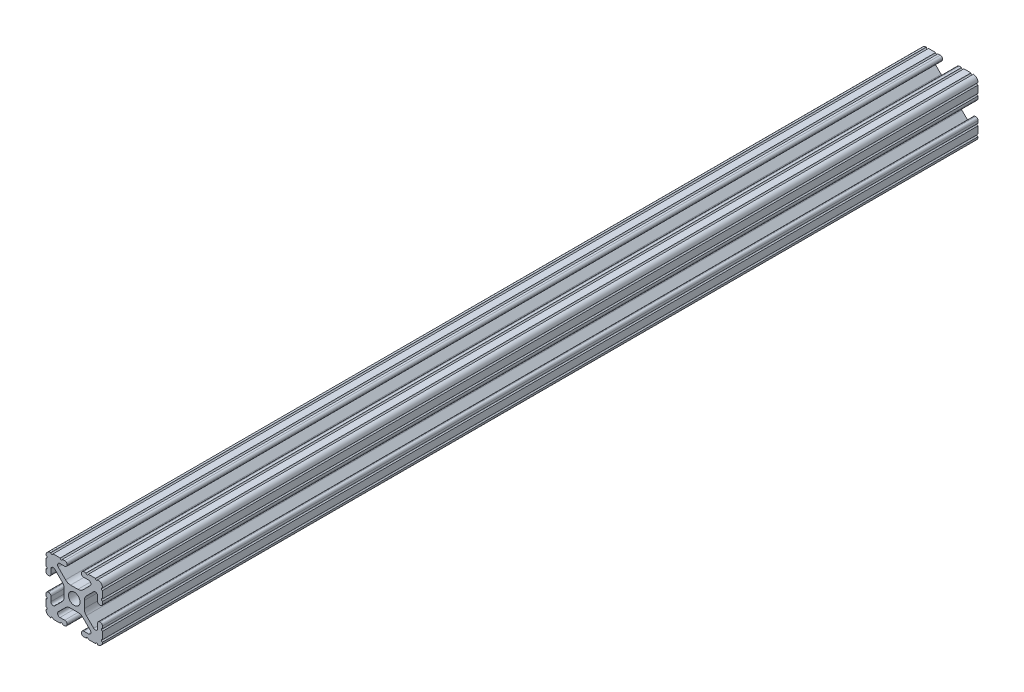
SolidWorks part; units mm, degrees
ref_plane "Front Plane" through (0, 0, 0) normal (0, 0, 1) x (1, 0, 0)
ref_plane "Top Plane" through (0, 0, 0) normal (0, 1, 0) x (1, 0, 0)
ref_plane "Right Plane" through (0, 0, 0) normal (1, 0, 0) x (0, 0, -1)
sketch "Sketch1" plane through (0, 0, 0) normal (0, 0, 1) x (1, 0, 0)
  line L88 (-7.1797, -8.6452) -> (-3.9523, -5.4237)
  line L89 (-1.7093, -4.4958) -> (1.7093, -4.4958)
  line L90 (3.9523, -5.4237) -> (7.1797, -8.6452)
  line L91 (6.4164, -10.4902) -> (4.2875, -10.4902)
  line L92 (3.2385, -11.5392) -> (3.2385, -11.651)
  line L93 (4.2875, -12.7) -> (5.3171, -12.7)
  line L94 (6.3331, -12.7) -> (9.5504, -12.7)
  line L95 (12.7, -9.5504) -> (12.7, -6.3331)
  line L96 (12.7, -5.3171) -> (12.7, -4.2875)
  line L97 (11.651, -3.2385) -> (11.5392, -3.2385)
  line L98 (10.4902, -4.2875) -> (10.4902, -6.4021)
  line L99 (8.7371, -7.1294) -> (5.441, -3.8408)
  line L100 (4.5085, -1.5932) -> (4.5085, 1.5932)
  line L101 (5.441, 3.8408) -> (8.7371, 7.1294)
  line L102 (10.4902, 6.4021) -> (10.4902, 4.2875)
  line L103 (11.5392, 3.2385) -> (11.651, 3.2385)
  line L104 (12.7, 4.2875) -> (12.7, 5.3171)
  line L105 (12.7, 6.3331) -> (12.7, 9.5504)
  line L106 (9.5504, 12.7) -> (6.3331, 12.7)
  line L107 (5.3171, 12.7) -> (4.2875, 12.7)
  line L108 (3.2385, 11.651) -> (3.2385, 11.5392)
  line L109 (4.2875, 10.4902) -> (6.4768, 10.4902)
  line L110 (7.207, 8.7244) -> (3.8983, 5.4232)
  line L111 (1.6558, 4.4958) -> (-1.6558, 4.4958)
  line L112 (-3.8983, 5.4232) -> (-7.207, 8.7244)
  line L113 (-6.4768, 10.4902) -> (-4.2875, 10.4902)
  line L114 (-3.2385, 11.5392) -> (-3.2385, 11.651)
  line L115 (-4.2875, 12.7) -> (-5.3171, 12.7)
  line L116 (-6.3331, 12.7) -> (-9.5504, 12.7)
  line L117 (-12.7, 9.5504) -> (-12.7, 6.3331)
  line L118 (-12.7, 5.3171) -> (-12.7, 4.2875)
  line L119 (-11.651, 3.2385) -> (-11.5392, 3.2385)
  line L120 (-10.4902, 4.2875) -> (-10.4902, 6.4021)
  line L121 (-8.7371, 7.1294) -> (-5.441, 3.8408)
  line L122 (-4.5085, 1.5932) -> (-4.5085, -1.5932)
  line L123 (-5.441, -3.8408) -> (-8.7371, -7.1294)
  line L124 (-10.4902, -6.4021) -> (-10.4902, -4.2875)
  line L125 (-11.5392, -3.2385) -> (-11.651, -3.2385)
  line L126 (-12.7, -4.2875) -> (-12.7, -5.3171)
  line L127 (-12.7, -6.3331) -> (-12.7, -9.5504)
  line L128 (-9.5504, -12.7) -> (-6.3331, -12.7)
  line L129 (-5.3171, -12.7) -> (-4.2875, -12.7)
  line L130 (-3.2385, -11.651) -> (-3.2385, -11.5392)
  line L131 (-4.2875, -10.4902) -> (-6.4164, -10.4902)
  circle A1 centre (0, 0) radius 2.6035
  arc A104 (-7.1797, -8.6452) -> (-6.4164, -10.4902) centre (-6.4164, -9.4098) ccw
  arc A105 (-1.7093, -4.4958) -> (-3.9523, -5.4237) centre (-1.7093, -7.6708) ccw
  arc A106 (3.9523, -5.4237) -> (1.7093, -4.4958) centre (1.7093, -7.6708) ccw
  arc A107 (6.4164, -10.4902) -> (7.1797, -8.6452) centre (6.4164, -9.4098) ccw
  arc A108 (4.2875, -10.4902) -> (3.2385, -11.5392) centre (4.2875, -11.5392) ccw
  arc A109 (3.2385, -11.651) -> (4.2875, -12.7) centre (4.2875, -11.651) ccw
  arc A110 (6.3331, -12.7) -> (5.3171, -12.7) centre (5.8251, -12.7) ccw
  arc A111 (10.5664, -12.6998) -> (9.5504, -12.7) centre (10.0584, -12.7) ccw
  arc A112 (10.5664, -12.6998) -> (12.6998, -10.5664) centre (10.5918, -10.5918) ccw
  arc A113 (12.7, -9.5504) -> (12.6998, -10.5664) centre (12.7, -10.0584) ccw
  arc A114 (12.7, -5.3171) -> (12.7, -6.3331) centre (12.7, -5.8251) ccw
  arc A115 (12.7, -4.2875) -> (11.651, -3.2385) centre (11.651, -4.2875) ccw
  arc A116 (11.5392, -3.2385) -> (10.4902, -4.2875) centre (11.5392, -4.2875) ccw
  arc A117 (8.7371, -7.1294) -> (10.4902, -6.4021) centre (9.4628, -6.4021) ccw
  arc A118 (4.5085, -1.5932) -> (5.441, -3.8408) centre (7.6835, -1.5932) ccw
  arc A119 (5.441, 3.8408) -> (4.5085, 1.5932) centre (7.6835, 1.5932) ccw
  arc A120 (10.4902, 6.4021) -> (8.7371, 7.1294) centre (9.4628, 6.4021) ccw
  arc A121 (10.4902, 4.2875) -> (11.5392, 3.2385) centre (11.5392, 4.2875) ccw
  arc A122 (11.651, 3.2385) -> (12.7, 4.2875) centre (11.651, 4.2875) ccw
  arc A123 (12.7, 6.3331) -> (12.7, 5.3171) centre (12.7, 5.8251) ccw
  arc A124 (12.6998, 10.5664) -> (12.7, 9.5504) centre (12.7, 10.0584) ccw
  arc A125 (12.6998, 10.5664) -> (10.5664, 12.6998) centre (10.5918, 10.5918) ccw
  arc A126 (9.5504, 12.7) -> (10.5664, 12.6998) centre (10.0584, 12.7) ccw
  arc A127 (5.3171, 12.7) -> (6.3331, 12.7) centre (5.8251, 12.7) ccw
  arc A128 (4.2875, 12.7) -> (3.2385, 11.651) centre (4.2875, 11.651) ccw
  arc A129 (3.2385, 11.5392) -> (4.2875, 10.4902) centre (4.2875, 11.5392) ccw
  arc A130 (7.207, 8.7244) -> (6.4768, 10.4902) centre (6.4768, 9.4563) ccw
  arc A131 (1.6558, 4.4958) -> (3.8983, 5.4232) centre (1.6558, 7.6708) ccw
  arc A132 (-3.8983, 5.4232) -> (-1.6558, 4.4958) centre (-1.6558, 7.6708) ccw
  arc A133 (-6.4768, 10.4902) -> (-7.207, 8.7244) centre (-6.4768, 9.4563) ccw
  arc A134 (-4.2875, 10.4902) -> (-3.2385, 11.5392) centre (-4.2875, 11.5392) ccw
  arc A135 (-3.2385, 11.651) -> (-4.2875, 12.7) centre (-4.2875, 11.651) ccw
  arc A136 (-6.3331, 12.7) -> (-5.3171, 12.7) centre (-5.8251, 12.7) ccw
  arc A137 (-10.5664, 12.6998) -> (-9.5504, 12.7) centre (-10.0584, 12.7) ccw
  arc A138 (-10.5664, 12.6998) -> (-12.6998, 10.5664) centre (-10.5918, 10.5918) ccw
  arc A139 (-12.7, 9.5504) -> (-12.6998, 10.5664) centre (-12.7, 10.0584) ccw
  arc A140 (-12.7, 5.3171) -> (-12.7, 6.3331) centre (-12.7, 5.8251) ccw
  arc A141 (-12.7, 4.2875) -> (-11.651, 3.2385) centre (-11.651, 4.2875) ccw
  arc A142 (-11.5392, 3.2385) -> (-10.4902, 4.2875) centre (-11.5392, 4.2875) ccw
  arc A143 (-8.7371, 7.1294) -> (-10.4902, 6.4021) centre (-9.4628, 6.4021) ccw
  arc A144 (-4.5085, 1.5932) -> (-5.441, 3.8408) centre (-7.6835, 1.5932) ccw
  arc A145 (-5.441, -3.8408) -> (-4.5085, -1.5932) centre (-7.6835, -1.5932) ccw
  arc A146 (-10.4902, -6.4021) -> (-8.7371, -7.1294) centre (-9.4628, -6.4021) ccw
  arc A147 (-10.4902, -4.2875) -> (-11.5392, -3.2385) centre (-11.5392, -4.2875) ccw
  arc A148 (-11.651, -3.2385) -> (-12.7, -4.2875) centre (-11.651, -4.2875) ccw
  arc A149 (-12.7, -6.3331) -> (-12.7, -5.3171) centre (-12.7, -5.8251) ccw
  arc A150 (-12.6998, -10.5664) -> (-12.7, -9.5504) centre (-12.7, -10.0584) ccw
  arc A151 (-12.6998, -10.5664) -> (-10.5664, -12.6998) centre (-10.5918, -10.5918) ccw
  arc A152 (-9.5504, -12.7) -> (-10.5664, -12.6998) centre (-10.0584, -12.7) ccw
  arc A153 (-5.3171, -12.7) -> (-6.3331, -12.7) centre (-5.8251, -12.7) ccw
  arc A154 (-4.2875, -12.7) -> (-3.2385, -11.651) centre (-4.2875, -11.651) ccw
  arc A155 (-3.2385, -11.5392) -> (-4.2875, -10.4902) centre (-4.2875, -11.5392) ccw
extrude "Boss-Extrude1" add sketch "Sketch1" along normal mid plane 393.7
